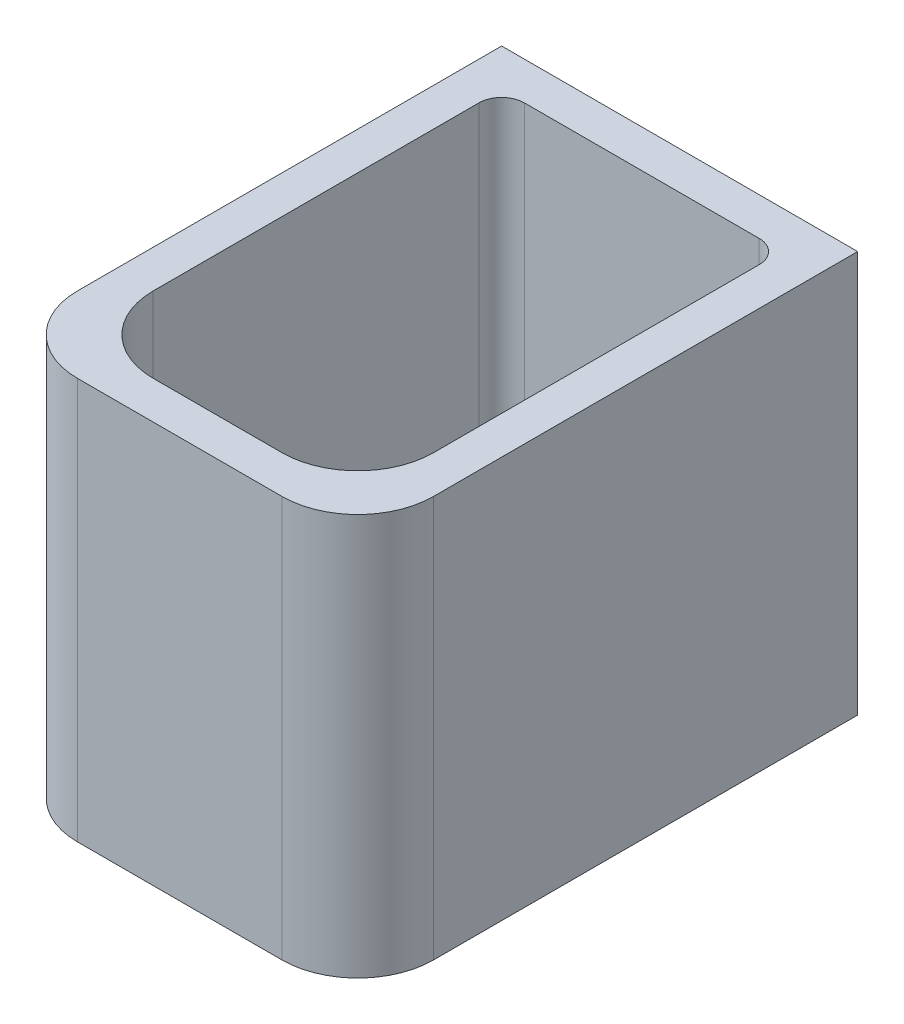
SolidWorks part; units mm, degrees
ref_plane "前视基准面" through (0, 0, 0) normal (0, 0, 1) x (1, 0, 0)
ref_plane "上视基准面" through (0, 0, 0) normal (0, 1, 0) x (1, 0, 0)
ref_plane "右视基准面" through (0, 0, 0) normal (1, 0, 0) x (0, 0, -1)
other "Configuration Table"
sketch "草图1" plane through (0, 0, 0) normal (0, 1, 0) x (1, 0, 0)
  line L1 (-2.35, -3.3) -> (2.35, -3.3)
  line L2 (-2.35, -3.3) -> (-2.35, 3.3)
  line L3 (-2.35, 3.3) -> (2.35, 3.3)
  line L4 (2.35, -3.3) -> (2.35, 3.3)
  line L5 (-2.35, -3.3) -> (2.35, 3.3) construction
  line L6 (-2.35, 3.3) -> (2.35, -3.3) construction
  point P0 (0, 0)
  dimension "D1" = 4.7
  dimension "D2" = 6.6
extrude "凸台-拉伸1" add sketch "草图1" along normal blind 0.3
sketch "草图2" plane through (0, 0.3, 0) normal (0, 1, 0) x (1, 0, 0)
  line L1 (-2.35, -3.3) -> (2.35, -3.3)
  line L2 (-2.35, -3.3) -> (-2.35, 3.3)
  line L3 (-2.35, 3.3) -> (2.35, 3.3)
  line L4 (2.35, -3.3) -> (2.35, 3.3)
  line L5 (-2.35, -3.3) -> (2.35, 3.3) construction
  line L6 (-2.35, 3.3) -> (2.35, -3.3) construction
  line L7 (-1.85, -2.8) -> (1.85, -2.8)
  line L8 (-1.85, -2.8) -> (-1.85, 2.8)
  line L9 (-1.85, 2.8) -> (1.85, 2.8)
  line L10 (1.85, -2.8) -> (1.85, 2.8)
  line L11 (-1.85, -2.8) -> (1.85, 2.8) construction
  line L12 (-1.85, 2.8) -> (1.85, -2.8) construction
  point P0 (0, 0)
  point P7 (0, 0)
  dimension "D1" = 0.5
  dimension "D2" = 0.5
extrude "凸台-拉伸2" add sketch "草图2" along normal blind 5
sketch "草图3" plane through (0, 5.3, 0) normal (0, 1, 0) x (1, 0, 0)
  line L1 (-2.35, -3.3) -> (2.35, -3.3)
  line L2 (-2.35, -3.3) -> (-2.35, 3.3)
  line L3 (-2.35, 3.3) -> (2.35, 3.3)
  line L4 (2.35, -3.3) -> (2.35, 3.3)
  line L5 (-2.35, -3.3) -> (2.35, 3.3) construction
  line L6 (-2.35, 3.3) -> (2.35, -3.3) construction
  point P0 (0, 0)
extrude "凸台-拉伸3" [suppressed] add sketch "草图3" along normal blind 0.3
fillet "圆角1" radius 1 4 edges at (-2.35, 2.65, 3.3) (-1.85, 2.8, 2.8) (1.85, 2.8, 2.8) (2.35, 2.65, 3.3)
fillet "圆角2" radius 0.3 2 edges at (-1.85, 2.8, -2.8) (1.85, 2.8, -2.8)
